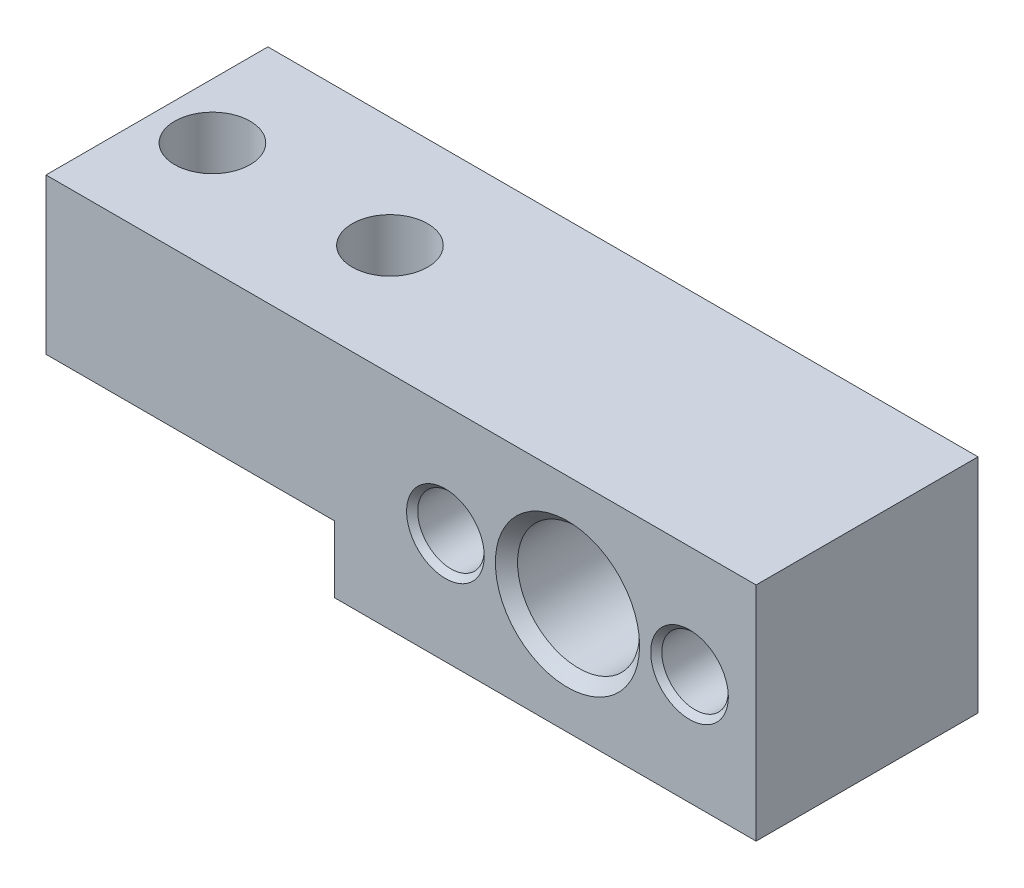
SolidWorks part; units mm, degrees
ref_plane "Face" through (0, 0, 0) normal (0, 0, 1) x (1, 0, 0)
ref_plane "Dessus" through (0, 0, 0) normal (0, 1, 0) x (1, 0, 0)
ref_plane "Droite" through (0, 0, 0) normal (1, 0, 0) x (0, 0, -1)
sketch "Esquisse1" plane through (0, 0, 0) normal (0, 0, 1) x (1, 0, 0)
  line L1 (-16, -5) -> (16, -5)
  line L2 (-16, -5) -> (-16, 5)
  line L3 (-16, 5) -> (16, 5)
  line L4 (16, -5) -> (16, 5)
  dimension "D1" = 10
  dimension "D2" = 32
  dimension "D3" = 5
  dimension "D4" = 16
extrude "Extrusion1" add sketch "Esquisse1" along normal blind 10
sketch "Esquisse2" plane through (0, 0, 10) normal (0, 0, 1) x (1, 0, 0)
  line L1 (-16, -5) -> (-3, -5)
  line L2 (-16, -5) -> (-16, -2)
  line L3 (-16, -2) -> (-3, -2)
  line L4 (-3, -5) -> (-3, -2)
  dimension "D1" = 13
  dimension "D2" = 3
extrude "Enlèv. mat.-Extru.1" cut sketch "Esquisse2" against normal through all
sketch "Esquisse3" plane through (0, 0, 10) normal (0, 0, 1) x (1, 0, 0)
  line L0 (0, 0) -> (20.2048, 0) construction
  line L1 (16, -5) -> (16, 5) construction
  circle A0 centre (7.5, 0) radius 2.75
  circle A1 centre (13, 0) radius 1.5
  circle A2 centre (2, 0) radius 1.5
  dimension "D1" = 3
  dimension "D2" = 5.5
  dimension "D3" = 11
  dimension "D4" = 3
  dimension "D5" = 8.5
  dimension "D6" = 5.5
extrude "Enlèv. mat.-Extru.2" cut sketch "Esquisse3" against normal through all
chamfer "Chanfrein1" distance 0.5 angle 45
chamfer "Chanfrein2" distance 0.25 angle 45
hole_wizard "Dégagement pour M31" positions "Esquisse6" profile "Esquisse5" hole size "M3" standard "ISO"
sketch "Esquisse6" plane through (0, 5, 0) normal (0, 1, 0) x (-1, 0, 0)
  circle A0 centre (5.5, 5) radius 1.2 construction
  circle A1 centre (13.5, 5) radius 1.2 construction
  point P0 (13.5, 5)
  point P1 (5.5, 5)
sketch "Esquisse5" plane through (-13.5, 5, 5) normal (1, 0, 0) x (0, 0, 1)
  line L0 (0, 0) -> (0, 10)
  line L1 (0, 10) -> (1.7, 10)
  line L2 (1.7, 10) -> (1.7, 0)
  line L5 (1.7, 0) -> (0, 0)
  line L11 (0, -6.35) -> (0, 107.95) construction
  dimension "Diamètre du perçage jusqu'au prochain" = 3.4
  dimension "Profondeur du perçage jusqu'au prochain" = 10
